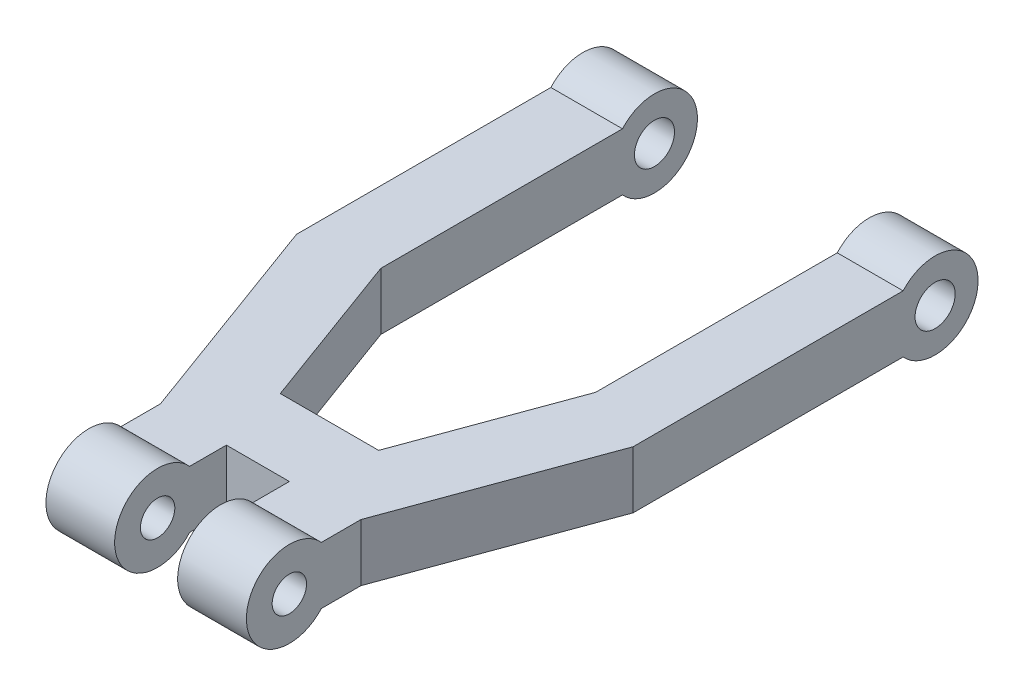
SolidWorks part; units mm, degrees
ref_plane "Front Plane" through (0, 0, 0) normal (0, 0, 1) x (1, 0, 0)
ref_plane "Top Plane" through (0, 0, 0) normal (0, 1, 0) x (1, 0, 0)
ref_plane "Right Plane" through (0, 0, 0) normal (1, 0, 0) x (0, 0, -1)
sketch "Sketch1" plane through (0, 0, 0) normal (1, 0, 0) x (0, 0, -1)
  line L1 (0, 0) -> (50.8, 0)
  line L2 (0, 0) -> (0, 5.08)
  line L3 (0, 5.08) -> (50.8, 5.08)
  line L4 (50.8, 0) -> (50.8, 5.08)
  dimension "D1" = 5.08
  dimension "D2" = 50.8
extrude "Boss-Extrude1" add sketch "Sketch1" along normal blind 31.242
sketch "Sketch2" plane through (31.242, 0, 0) normal (1, 0, 0) x (0, 0, -1)
  line L0 (0, 5.08) -> (0, 0) construction
  line L1 (50.8, 0) -> (50.8, 5.08) construction
  circle A0 centre (0, 2.54) radius 3.81
  circle A1 centre (50.8, 2.54) radius 3.81
  dimension "D1" = 7.62
  dimension "D2" = 7.62
extrude "Boss-Extrude2" add sketch "Sketch2" against normal blind 31.242
sketch "Sketch3" plane through (0, 5.08, 0) normal (0, 1, 0) x (1, 0, 0)
  line L0 (0, 25.4) -> (6.985, 6.35)
  line L1 (0, 47.9602) -> (0, 2.8398) construction
  line L2 (6.985, 6.35) -> (6.985, -6.1726)
  line L3 (6.985, -6.1726) -> (-2.6073, -6.1726)
  line L4 (-2.6073, -6.1726) -> (-2.6073, 25.4)
  line L5 (-2.6073, 25.4) -> (0, 25.4)
  line L6 (15.875, -8.3954) -> (15.875, 60.0398) construction
  line L7 (6.35, 57.9101) -> (6.35, 26.5275)
  line L8 (6.35, 26.5275) -> (11.5119, 12.4494)
  line L9 (11.5119, 12.4494) -> (20.2381, 12.4494)
  line L10 (6.35, 57.9101) -> (25.4, 57.9101)
  line L11 (25.4, 57.9101) -> (25.4, 26.5275)
  line L12 (25.4, 26.5275) -> (20.2381, 12.4494)
  line L13 (34.3573, -6.1726) -> (34.3573, 25.4)
  line L14 (24.765, -6.1726) -> (34.3573, -6.1726)
  line L15 (24.765, 6.35) -> (24.765, -6.1726)
  line L16 (31.75, 25.4) -> (24.765, 6.35)
  line L17 (34.3573, 25.4) -> (31.75, 25.4)
  line L19 (13.081, 6.0994) -> (18.669, 6.0994)
  line L20 (13.081, 6.0994) -> (13.081, -7.5618)
  line L21 (13.081, -7.5618) -> (18.669, -7.5618)
  line L22 (18.669, 6.0994) -> (18.669, -7.5618)
  line L23 (13.081, 6.0994) -> (18.669, -7.5618) construction
  line L24 (13.081, -7.5618) -> (18.669, 6.0994) construction
  point P15 (15.875, 57.9101)
  point P17 (15.875, 12.4494)
  point P22 (15.875, -0.7312)
  dimension "D1" = 19.05
  dimension "D2" = 8.89
  dimension "D3" = 6.35
  dimension "D4" = 6.35
  dimension "D5" = 5.588
  dimension "D6" = 6.35
extrude "Cut-Extrude1" cut sketch "Sketch3" against normal through all both and the other way through all
sketch "Sketch4" plane through (0, 0, 0) normal (-1, 0, 0) x (0, 0, 1)
  circle A0 centre (-50.8, 2.54) radius 1.778
  circle A1 centre (0, 2.54) radius 1.524
  dimension "D1" = 3.048
  dimension "D2" = 3.556
extrude "Cut-Extrude2" cut sketch "Sketch4" against normal through all
